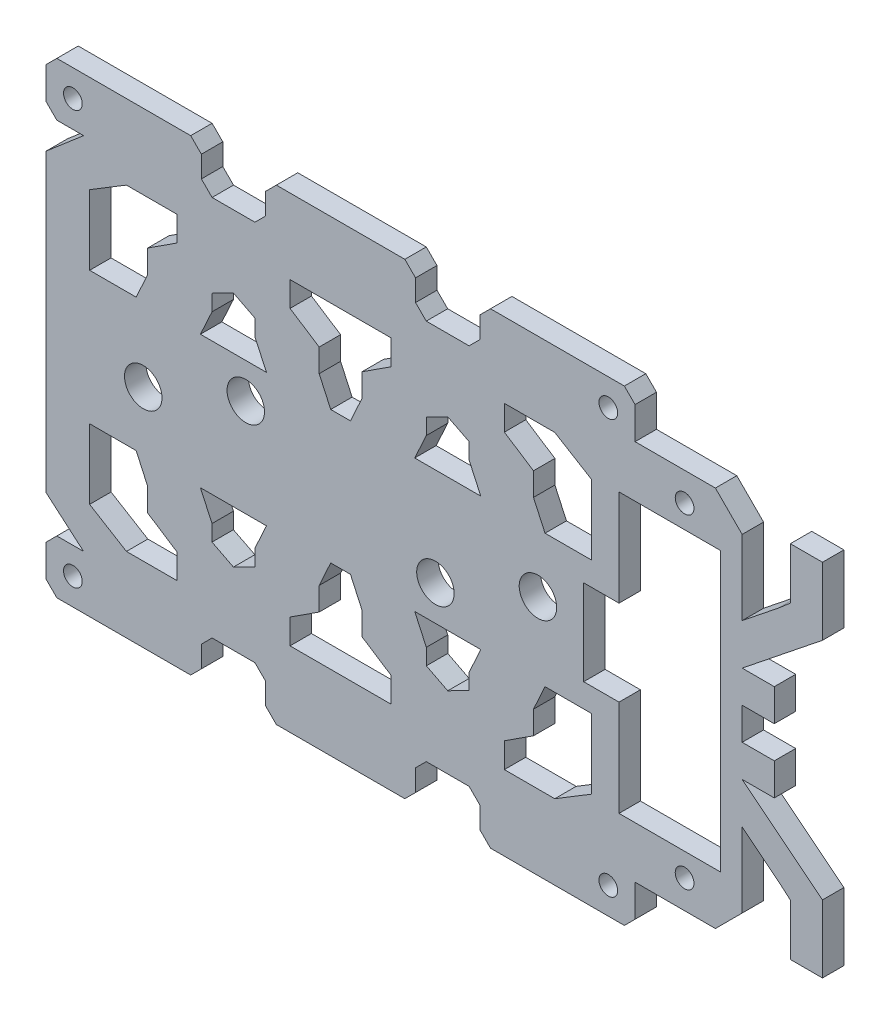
SolidWorks part; units mm, degrees
ref_plane "Front Plane" through (0, 0, 0) normal (0, 0, 1) x (1, 0, 0)
ref_plane "Top Plane" through (0, 0, 0) normal (0, 1, 0) x (1, 0, 0)
ref_plane "Right Plane" through (0, 0, 0) normal (1, 0, 0) x (0, 0, -1)
sketch "Sketch17" [suppressed] plane through (0, 0, 4) normal (0, 0, 1) x (1, 0, 0)
  line L0 (-55, 12.125) -> (-45, 18.2974) construction
  line L1 (-55, 2.5) -> (-55, 39.75) construction
  line L2 (-45, 18.2974) -> (-45, 21.125) construction
  line L3 (-55, 21.125) -> (55, 21.125) construction
  line L4 (-55, 21.125) -> (-55, 12.125) construction
  line L5 (-55, 21.125) -> (55, 21.125) construction
  line L6 (-40, 0) -> (-47.5612, -9.9538) construction
  line L7 (-45, 21.125) -> (-35.9886, 21.125) construction
  line L8 (-40, 0) -> (-45.6995, 11.125) construction
  line L9 (-55, 30.125) -> (-55, 12.125)
  line L10 (-55, 12.125) -> (-45, 18.2974)
  line L11 (-45, 18.2974) -> (-45, 23.9526)
  line L12 (-55, 30.125) -> (-45, 23.9526)
  line L13 (0, 21.125) -> (0, -26.5) construction
  line L14 (55, 12.125) -> (45, 18.2974)
  line L15 (45, 18.2974) -> (45, 23.9526)
  line L16 (55, 30.125) -> (45, 23.9526)
  line L17 (55, 30.125) -> (55, 12.125)
  circle A1 centre (-40, 0) radius 12.5 construction
  point P26 (45, 21.125)
  dimension "D1" = 9
  dimension "D2" = 10
sketch "Sketch46" [suppressed] plane through (0, 0, 4) normal (0, 0, 1) x (1, 0, 0)
  line L0 (34.7834, 34.9205) -> (35.1925, 30.791) construction
  line L1 (35.1925, 30.791) -> (40, 30.791) construction
  line L2 (10, 54.75) -> (10, 43.9931)
  line L3 (15.3638, 40.3741) -> (25.307, 40.3741)
  line L4 (10, 54.75) -> (25.9432, 54.75)
  line L5 (43.3566, 54.75) -> (47, 50.3534)
  line L6 (47, 50.3534) -> (47, 34.0649)
  line L7 (47, 34.0649) -> (40, 30.791)
  line L8 (31.307, 40.3741) -> (34.7834, 34.9205)
  line L9 (34.7834, 34.9205) -> (35.1925, 30.791)
  line L10 (-45, 21.125) -> (-35.1925, 21.125) construction
  line L13 (-4, 60.0044) -> (4, 60.0044) construction
  line L14 (31.307, 51.131) -> (36.6708, 54.75)
  line L15 (31.307, 40.3741) -> (31.307, 54.75) construction
  line L16 (34.7834, 34.9205) -> (31.307, 40.3741) construction
  line L17 (47, 50.3534) -> (42.1411, 53.2998) construction
  line L18 (35.1925, 30.791) -> (40, 30.791)
  line L19 (36.6708, -12.5) -> (43.3566, -12.5)
  line L20 (31.307, 54.75) -> (10, 40.3741) construction
  line L21 (31.307, 40.3741) -> (29.9457, 38.75) construction
  line L22 (43.3566, -12.5) -> (47, -8.1034)
  line L23 (47, -8.1034) -> (47, 8.1851)
  line L24 (47, 8.1851) -> (40, 11.459)
  line L25 (35.1925, 11.459) -> (40, 11.459)
  line L26 (34.7834, 7.3295) -> (35.1925, 11.459)
  line L27 (31.307, 1.8759) -> (34.7834, 7.3295)
  line L28 (31.307, 1.8759) -> (31.307, -8.881)
  line L29 (31.307, -8.881) -> (36.6708, -12.5)
  line L30 (15.3638, 1.8759) -> (25.307, 1.8759)
  line L31 (25.307, -4.8328) -> (25.307, 1.8759)
  line L32 (25.307, -4.8328) -> (15.3638, 1.8759)
  line L33 (25.9432, -12.5) -> (10, -1.7431)
  line L34 (10, -12.5) -> (10, -1.7431)
  line L35 (10, -12.5) -> (25.9432, -12.5)
  line L36 (-10, 54.75) -> (-10, 43.9931)
  line L37 (36.6708, 54.75) -> (43.3566, 54.75)
  line L38 (-10, 54.75) -> (-25.9432, 54.75)
  line L39 (-25.9432, 54.75) -> (-10, 43.9931)
  line L40 (-25.307, 47.0828) -> (-15.3638, 40.3741)
  line L41 (-25.307, 47.0828) -> (-25.307, 40.3741)
  line L42 (-15.3638, 40.3741) -> (-25.307, 40.3741)
  line L43 (-35.1925, 30.791) -> (-40, 30.791)
  line L44 (-34.7834, 34.9205) -> (-35.1925, 30.791)
  line L45 (-31.307, 40.3741) -> (-34.7834, 34.9205)
  line L46 (-31.307, 40.3741) -> (-31.307, 51.131)
  line L47 (-31.307, 51.131) -> (-36.6708, 54.75)
  line L48 (-36.6708, 54.75) -> (-43.3566, 54.75)
  line L49 (-43.3566, 54.75) -> (-47, 50.3534)
  line L50 (-47, 50.3534) -> (-47, 34.0649)
  line L51 (-47, 34.0649) -> (-40, 30.791)
  line L52 (-31.307, 1.8759) -> (-34.7834, 7.3295)
  line L53 (-34.7834, 7.3295) -> (-35.1925, 11.459)
  line L54 (-35.1925, 11.459) -> (-40, 11.459)
  line L55 (-47, 8.1851) -> (-40, 11.459)
  line L56 (-47, -8.1034) -> (-47, 8.1851)
  line L57 (-31.307, -8.881) -> (-36.6708, -12.5)
  line L58 (-43.3566, -12.5) -> (-47, -8.1034)
  line L59 (-36.6708, -12.5) -> (-43.3566, -12.5)
  line L60 (-31.307, 1.8759) -> (-31.307, -8.881)
  line L61 (-15.3638, 1.8759) -> (-25.307, 1.8759)
  line L62 (-25.307, -4.8328) -> (-25.307, 1.8759)
  line L63 (-25.307, -4.8328) -> (-15.3638, 1.8759)
  line L64 (-25.9432, -12.5) -> (-10, -1.7431)
  line L65 (-10, -12.5) -> (-10, -1.7431)
  line L66 (-10, -12.5) -> (-25.9432, -12.5)
  line L67 (-40, 21.125) -> (-35.1925, 21.125) construction
  line L68 (-40, 16.125) -> (-35.1925, 16.125)
  line L69 (-40, 26.125) -> (-35.1925, 26.125)
  line L70 (-40, 21.125) -> (-40, 26.125)
  line L71 (-40, 21.125) -> (-40, 16.125)
  line L72 (-35.1925, 26.125) -> (-35.1925, 21.125)
  line L73 (-35.1925, 21.125) -> (-35.1925, 16.125)
  line L75 (35.1925, 21.125) -> (35.1925, 16.125)
  line L76 (35.1925, 26.125) -> (35.1925, 21.125)
  line L77 (40, 21.125) -> (40, 16.125)
  line L78 (40, 21.125) -> (40, 26.125)
  line L81 (35.1925, 16.125) -> (40, 16.125)
  line L82 (35.1925, 26.125) -> (40, 26.125)
  line L83 (25.9432, 54.75) -> (10, 43.9931)
  line L85 (-4, 60.0044) -> (4, 60.0044)
  line L87 (31.307, 40.3741) -> (31.307, 51.131)
  line L88 (25.307, 40.3741) -> (25.307, 47.0828) construction
  line L89 (25.307, 47.0828) -> (25.307, 40.3741)
  line L90 (25.307, 47.0828) -> (15.3638, 40.3741)
  line L91 (-4, -17.7544) -> (4, -17.7544) construction
  line L92 (4, 60.0044) -> (4, 40.3741)
  line L94 (-4, 60.0044) -> (-4, 40.3741)
  line L95 (-4, -17.7544) -> (4, -17.7544)
  line L96 (-4, 40.3741) -> (4, 40.3741)
  line L107 (-4, 1.8759) -> (4, 1.8759)
  line L108 (-4, 1.8759) -> (-4, -17.7544)
  line L109 (0, 1.8759) -> (0, -15) construction
  line L110 (4, 1.8759) -> (4, -17.7544)
  line L114 (0, 60.0044) -> (0, 40.3741) construction
  line L115 (35.1925, 21.125) -> (45, 21.125) construction
  line L202 (53.2, 66.95) -> (-53.2, 66.95)
  line L204 (-53.2, 66.95) -> (-53.2, -24.7)
  line L221 (-53.2, -24.7) -> (53.2, -24.7)
  line L277 (53.2, -24.7) -> (53.2, 66.95)
sketch "Sketch49" [suppressed] plane through (0, 0, 0) normal (0, 0, 1) x (1, 0, 0)
  line L0 (-45, 21.125) -> (-23.78, 21.125) construction
  line L1 (-45, 18.2974) -> (-45, 23.9526) construction
  line L2 (45, 23.9526) -> (45, 18.2974) construction
  line L3 (-27.28, 14.94) -> (-27.28, 21.125) construction
  line L4 (-27.28, 21.125) -> (-27.28, 33.94) construction
  line L5 (-27.28, 14.94) -> (-27.28, 11.94) construction
  line L7 (-30.78, 11.94) -> (-23.78, 11.94)
  line L8 (-23.78, 11.94) -> (-23.78, 33.94)
  line L9 (-30.78, 10.44) -> (-23.78, 10.44)
  line L10 (-22.28, 21.125) -> (-22.28, 13.726)
  line L11 (-22.28, 13.726) -> (-22.28, 10.44)
  line L12 (-22.28, 10.44) -> (-23.78, 10.44)
  line L13 (-23.78, 33.94) -> (-22.28, 33.94)
  line L14 (-22.28, 33.94) -> (-22.28, 21.125)
  line L15 (-22.28, 21.125) -> (45, 21.125) construction
  line L16 (-32.28, 10.44) -> (-30.78, 10.44)
  line L17 (-32.28, 13.726) -> (-32.28, 10.44)
  line L18 (-32.28, 21.125) -> (-32.28, 13.726)
  line L19 (-32.28, 33.94) -> (-32.28, 21.125)
  line L20 (-30.78, 11.94) -> (-30.78, 33.94)
  line L21 (-30.78, 33.94) -> (-32.28, 33.94)
  line L22 (0, 21.125) -> (0, 68.75) construction
  line L23 (27.28, 27.31) -> (27.28, 8.31) construction
  line L24 (27.28, 27.31) -> (27.28, 30.31) construction
  line L25 (30.78, 30.31) -> (23.78, 30.31)
  line L26 (23.78, 30.31) -> (23.78, 8.31)
  line L27 (23.78, 8.31) -> (22.28, 8.31)
  line L28 (22.28, 8.31) -> (22.28, 29.3349)
  line L29 (27.28, 30.31) -> (27.28, 31.81) construction
  line L30 (32.28, 31.81) -> (22.28, 31.81)
  line L31 (22.28, 31.81) -> (22.28, 29.3349)
  line L32 (30.78, 8.31) -> (32.28, 8.31)
  line L33 (30.78, 30.31) -> (30.78, 8.31)
  line L34 (32.28, 8.31) -> (32.28, 29.3349)
  line L35 (32.28, 31.81) -> (32.28, 29.3349)
  point P23 (-27.28, 10.44)
  dimension "D6" = 19
  dimension "D7" = 3
  dimension "D8" = 3.5
  dimension "D9" = 1.5
  dimension "D10" = 1.5
sketch "Sketch51" plane through (0, 0, 0) normal (0, 0, 1) x (1, 0, 0)
  line L0 (-55, 60.75) -> (-55, 50.75)
  line L1 (-55, -16.5) -> (-55, -26.5) construction
  line L2 (-55, -26.5) -> (55, -26.5) construction
  line L3 (75, 17.125) -> (75, 33.8069) construction
  line L4 (-55, -26.5) -> (55, -26.5)
  line L5 (55, 60.75) -> (55, 54.625)
  line L6 (0, 4.7155) -> (0, 60.75) construction
  line L7 (-55, 60.75) -> (55, 60.75)
  line L8 (-55, 17.125) -> (75, 17.125) construction
  line L9 (-4, -2.1241) -> (-4, -4.3102) construction
  line L10 (1.8445, 4.7155) -> (4, 0)
  line L11 (4, -2.1241) -> (4, 0)
  line L12 (4, -2.1241) -> (4, -4.3102)
  line L13 (-48, 50.75) -> (-55, 50.75)
  line L14 (4, -4.3102) -> (9.4424, -7.8357)
  line L15 (9.4424, -7.8357) -> (9.4424, -12.5)
  line L16 (-55, 44.75) -> (-48, 50.75)
  line L17 (16.0138, 0) -> (16.0138, -3)
  line L18 (13.8445, 4.7155) -> (16.0138, 0)
  line L19 (-55, -16.5) -> (-55, -26.5)
  line L20 (-1.8445, 4.7155) -> (1.8445, 4.7155)
  line L21 (-9.4424, -7.8357) -> (-9.4424, -12.5) construction
  line L22 (16.0138, -3) -> (20.0138, -5.0367)
  line L23 (-55, -26.5) -> (-55, 60.75)
  line L24 (-4, -2.1241) -> (-4, -4.3102)
  line L25 (26.183, 4.7155) -> (24.0275, 0)
  line L26 (-38.183, 4.7155) -> (-41.872, 4.7155)
  line L27 (-26.183, 4.7155) -> (-24.0275, 0)
  line L28 (-55, -10.5) -> (-48, -16.5)
  line L29 (-38.183, 4.7155) -> (-36.0275, 0)
  line L30 (-36.0275, -2.1241) -> (-36.0275, 0)
  line L31 (-36.0275, -2.1241) -> (-36.0275, -4.3102)
  line L32 (-36.0275, -4.3102) -> (-30.5852, -7.8357)
  line L33 (-30.5852, -7.8357) -> (-30.5852, -12.5)
  line L34 (0, 4.7155) -> (0, -26.5) construction
  line L35 (26.183, 4.7155) -> (13.8445, 4.7155)
  line L36 (24.0138, 0) -> (24.0138, -3)
  line L37 (24.0138, -3) -> (20.0138, -5.0367)
  line L38 (30.5852, -12.5) -> (40, -12.5)
  line L39 (-30.5852, -12.5) -> (-40, -12.5)
  line L40 (-48, -16.5) -> (-55, -16.5)
  line L41 (-41.872, 4.7155) -> (-46.872, 4.7155)
  line L42 (-4, -4.3102) -> (-9.4424, -7.8357) construction
  line L43 (30.5852, -7.8357) -> (30.5852, -12.5)
  line L44 (36.0275, -4.3102) -> (30.5852, -7.8357)
  line L45 (36.0275, -2.1241) -> (36.0275, -4.3102)
  line L46 (36.0275, -2.1241) -> (36.0275, 0)
  line L47 (38.183, 4.7155) -> (36.0275, 0)
  line L48 (75, 17.125) -> (93.6787, 17.125) construction
  line L49 (75, 20.125) -> (75, 14.125)
  line L50 (46.872, 4.7155) -> (46.872, -8.3277)
  line L51 (40, -12.5) -> (46.872, -8.3277)
  line L52 (-4, -4.3102) -> (-9.4424, -7.8357)
  line L53 (-9.4424, -7.8357) -> (-9.4424, -12.5)
  line L54 (-9.4424, -12.5) -> (9.4424, -12.5)
  line L55 (-26.183, 29.5345) -> (-13.8445, 29.5345) construction
  line L56 (-4, 38.5602) -> (-9.4424, 42.0857) construction
  line L57 (-9.4424, 42.0857) -> (-9.4424, 46.75) construction
  line L58 (-4, 36.3741) -> (-4, 38.5602) construction
  line L59 (-26.183, 29.5345) -> (-13.8445, 29.5345)
  line L60 (-16.0138, 37.25) -> (-20.0138, 39.2867)
  line L61 (-24.0138, 37.25) -> (-20.0138, 39.2867)
  line L62 (-16.0138, 34.25) -> (-16.0138, 37.25)
  line L63 (-26.183, 29.5345) -> (-24.0138, 34.25)
  line L64 (-24.0138, 34.25) -> (-24.0138, 37.25)
  line L65 (-13.8445, 29.5345) -> (-16.0138, 34.25)
  line L66 (-40, 46.75) -> (-46.872, 42.5777)
  line L67 (-1.8445, 29.5345) -> (-4, 34.25)
  line L68 (-4, 36.3741) -> (-4, 34.25)
  line L69 (-46.872, 29.5345) -> (-46.872, 42.5777)
  line L70 (-9.4424, 46.75) -> (9.4424, 46.75)
  line L71 (-9.4424, 42.0857) -> (-9.4424, 46.75)
  line L72 (-4, 38.5602) -> (-9.4424, 42.0857)
  line L73 (40, 46.75) -> (46.872, 42.5777)
  line L74 (46.872, 29.5345) -> (46.872, 42.5777)
  line L75 (55, 54.625) -> (55, 52.75)
  line L76 (-46.872, 4.7155) -> (-46.872, -8.3277)
  line L77 (-4, -2.1241) -> (-4, 0)
  line L79 (38.183, 29.5345) -> (36.0275, 34.25)
  line L80 (36.0275, 36.3741) -> (36.0275, 34.25)
  line L81 (36.0275, 36.3741) -> (36.0275, 38.5602)
  line L82 (36.0275, 38.5602) -> (30.5852, 42.0857)
  line L83 (30.5852, 42.0857) -> (30.5852, 46.75)
  line L84 (-48, -16.5) -> (-55, -16.5)
  line L85 (55, -26.5) -> (55, -18.5)
  line L88 (75, 46.75) -> (75, 33.8069)
  line L89 (-48, 50.75) -> (-55, 50.75)
  line L90 (-1.8445, 4.7155) -> (-4, 0)
  line L91 (-26, -18.5) -> (-26, -26.5)
  line L92 (-26, -18.5) -> (-14, -18.5)
  line L93 (-14, -18.5) -> (-14, -26.5)
  line L94 (14, -18.5) -> (14, -26.5)
  line L95 (14, -18.5) -> (26, -18.5)
  line L96 (26, -18.5) -> (26, -26.5)
  line L97 (26, 52.75) -> (26, 60.75)
  line L98 (14, 52.75) -> (26, 52.75)
  line L99 (14, 52.75) -> (14, 60.75)
  line L100 (-14, 52.75) -> (-14, 60.75)
  line L101 (-26, 52.75) -> (-14, 52.75)
  line L102 (-26, 52.75) -> (-26, 60.75)
  line L103 (-41.872, 29.5345) -> (-46.872, 29.5345)
  line L104 (-30.5852, 46.75) -> (-40, 46.75)
  line L105 (30.5852, 46.75) -> (40, 46.75)
  line L106 (-40, -12.5) -> (-46.872, -8.3277)
  line L107 (24.0138, 37.25) -> (20.0138, 39.2867)
  line L108 (24.0138, 34.25) -> (24.0138, 37.25)
  line L109 (26.183, 29.5345) -> (13.8445, 29.5345)
  line L110 (-30.5852, 42.0857) -> (-30.5852, 46.75)
  line L111 (-36.0275, 38.5602) -> (-30.5852, 42.0857)
  line L112 (-36.0275, 36.3741) -> (-36.0275, 38.5602)
  line L113 (-36.0275, 36.3741) -> (-36.0275, 34.25)
  line L114 (-38.183, 29.5345) -> (-36.0275, 34.25)
  line L115 (-13.8445, 4.7155) -> (-16.0138, 0)
  line L116 (-24.0138, 0) -> (-24.0138, -3)
  line L117 (-26.183, 4.7155) -> (-24.0138, 0)
  line L118 (-26.183, 4.7155) -> (-13.8445, 4.7155) construction
  line L119 (-55, -26.5) -> (-55, -16.5)
  line L120 (-16.0138, 0) -> (-16.0138, -3)
  line L121 (-24.0138, -3) -> (-20.0138, -5.0367)
  line L122 (-16.0138, -3) -> (-20.0138, -5.0367)
  line L123 (-26.183, 4.7155) -> (-13.8445, 4.7155)
  line L124 (-26.183, 29.5345) -> (-24.0275, 34.25)
  line L125 (-38.183, 29.5345) -> (-41.872, 29.5345)
  line L126 (26.183, 29.5345) -> (24.0275, 34.25)
  line L127 (-4, 36.3741) -> (-4, 38.5602)
  line L128 (16.0138, 37.25) -> (20.0138, 39.2867)
  line L129 (-1.8445, 29.5345) -> (1.8445, 29.5345)
  line L130 (13.8445, 29.5345) -> (16.0138, 34.25)
  line L131 (16.0138, 34.25) -> (16.0138, 37.25)
  line L132 (9.4424, 42.0857) -> (9.4424, 46.75)
  line L133 (4, 38.5602) -> (9.4424, 42.0857)
  line L134 (4, 36.3741) -> (4, 38.5602)
  line L135 (4, 36.3741) -> (4, 34.25)
  line L136 (1.8445, 29.5345) -> (4, 34.25)
  line L137 (75, -12.5) -> (75, 0.4431)
  line L139 (65, 46.75) -> (65, 17.125) construction
  line L140 (75, -12.5) -> (75, -18.5)
  line L141 (-48, -16.5) -> (-55, -16.5)
  line L142 (75, -18.5) -> (55, -18.5)
  line L143 (75, 46.75) -> (75, 52.75)
  line L144 (75, 14.125) -> (81, 14.125)
  line L145 (81, 14.125) -> (81, 8.125)
  line L146 (81, 8.125) -> (75, 8.125)
  line L147 (75, 8.125) -> (83.3808, 1.4246)
  line L148 (83.3808, 1.4246) -> (90, -3.8675)
  line L149 (90, -3.8675) -> (90, -16.5)
  line L150 (90, -16.5) -> (84, -16.5)
  line L151 (75, 0.4431) -> (79.6341, -3.2618)
  line L152 (79.6341, -3.2618) -> (81.737, -4.9431)
  line L153 (81.737, -4.9431) -> (81.737, -4.9431)
  line L154 (81.737, -4.9431) -> (81.737, -4.9431)
  line L155 (75, 14.125) -> (75, 20.125)
  line L156 (75, 14.125) -> (75, 20.125) construction
  line L157 (84, -10.5) -> (84, -16.5)
  line L158 (81.737, -4.9431) -> (81.737, -4.9431)
  line L159 (75, 52.75) -> (55, 52.75)
  line L160 (84, -10.5) -> (84, -6.8809)
  line L161 (81.737, -4.9431) -> (84, -6.8809)
  line L162 (71.2533, 3.4386) -> (79.6341, -3.2618) construction
  line L163 (81.737, 39.1931) -> (84, 41.1309)
  line L164 (84, 44.75) -> (84, 41.1309)
  line L166 (84, 44.75) -> (84, 50.75)
  line L167 (79.6341, 37.5118) -> (81.737, 39.1931)
  line L168 (75, 33.8069) -> (79.6341, 37.5118)
  line L169 (90, 50.75) -> (84, 50.75)
  line L170 (90, 38.1175) -> (90, 50.75)
  line L171 (83.3808, 32.8254) -> (90, 38.1175)
  line L172 (75, 26.125) -> (83.3808, 32.8254)
  line L173 (81, 26.125) -> (75, 26.125)
  line L174 (81, 20.125) -> (81, 26.125)
  line L175 (75, 20.125) -> (81, 20.125)
  line L177 (46.872, 4.7155) -> (38.183, 4.7155)
  line L178 (46.872, 29.5345) -> (38.183, 29.5345)
  circle A2 centre (-50, -21.5) radius 1.75
  circle A3 centre (-40, -22.5) radius 2.5
  circle A4 centre (0, -22.5) radius 2.5
  circle A5 centre (40, -22.5) radius 2.5
  circle A6 centre (50, -21.5) radius 1.75
  circle A7 centre (50, 55.75) radius 1.75
  circle A8 centre (40, 56.75) radius 2.5
  circle A9 centre (0, 56.75) radius 2.5
  circle A10 centre (-40, 56.75) radius 2.5
  circle A11 centre (-50, 55.75) radius 1.75
  point P22 (0, -12.5)
  point P40 (0, -12.5)
  point P43 (0, -2.1241)
  point P87 (-47, 17.125)
  point P93 (65, 52.75)
  point P95 (65, -18.5)
  point P161 (0, 36.3741)
  point P162 (0, 46.75)
  dimension "D2" = 6
  dimension "D3" = 6
  dimension "D1" = 29.625
  dimension "D4" = 8
  dimension "D5" = 71.25
extrude "Boss-Extrude2" add sketch "Sketch51" along normal blind 4
sketch "Sketch52" [suppressed] plane through (0, 0, 4) normal (0, 0, 1) x (1, 0, 0)
  line L0 (0, 36.3741) -> (0, -2.1241) construction
  line L2 (35.6535, 29.5345) -> (35.6535, 4.7155) construction
  line L5 (0, 31.3741) -> (0, 17.125) construction
  line L6 (0, 17.125) -> (0, 2.8759) construction
  line L7 (-18.5852, 42.0857) -> (-18.5852, -7.8357) construction
  line L8 (24.0275, 38.5602) -> (24.0275, 0) construction
  line L9 (0, 31.3741) -> (-18.5852, 31.3741) construction
  line L10 (-18.5852, 17.125) -> (-18.5852, 31.3741)
  line L11 (-18.5852, 31.3741) -> (55, 31.3741)
  line L13 (-18.5852, 17.125) -> (-18.5852, 2.8759) construction
  line L14 (-18.5852, 2.8759) -> (0, 2.8759) construction
  line L15 (0, 2.8759) -> (55, 2.8759) construction
  line L16 (55, 2.8759) -> (55, 31.3741) construction
  line L17 (-18.5852, 17.125) -> (-18.5852, 2.8759)
  line L18 (-18.5852, 2.8759) -> (0, 2.8759)
  line L19 (0, 2.8759) -> (55, 2.8759)
  line L20 (55, 2.8759) -> (55, 31.3741)
extrude "Cut-Extrude4" [suppressed] cut sketch "Sketch52" against normal blind 2
sketch "Sketch53" plane through (0, 0, 4) normal (0, 0, 1) x (1, 0, 0)
  line L0 (13.8445, 29.5345) -> (26.183, 29.5345)
  line L1 (26.183, 29.5345) -> (24.0138, 34.25)
  line L2 (24.0138, 34.25) -> (24.0138, 37.25)
  line L3 (24.0138, 37.25) -> (20.0138, 39.2867)
  line L4 (20.0138, 39.2867) -> (16.0138, 37.25)
  line L5 (16.0138, 37.25) -> (16.0138, 34.25)
  line L6 (16.0138, 34.25) -> (13.8445, 29.5345)
  line L7 (13.8445, 4.7155) -> (26.183, 4.7155)
  line L8 (26.183, 4.7155) -> (24.0275, 0)
  line L9 (24.0275, 0) -> (24.0138, -3)
  line L10 (24.0138, -3) -> (20.0138, -5.0367)
  line L11 (20.0138, -5.0367) -> (16.0138, -3)
  line L12 (16.0138, -3) -> (16.0138, 0)
  line L13 (16.0138, 0) -> (13.8445, 4.7155)
extrude "Cut-Extrude5" cut sketch "Sketch53" against normal through all
sketch "Sketch54" plane through (0, 0, 4) normal (0, 0, 1) x (1, 0, 0)
  line L0 (38.183, 29.5345) -> (38.183, 4.7155)
  line L1 (38.183, 4.7155) -> (46.872, 4.7155)
  line L2 (46.872, 4.7155) -> (46.872, 29.5345)
  line L3 (46.872, 29.5345) -> (38.183, 29.5345)
extrude "Cut-Extrude6" [suppressed] cut sketch "Sketch54" against normal through all
chamfer "Chamfer1" distance 2 angle 45 22 edges at (26, -18.5, 2) (-14, -18.5, 2) (-14, -26.5, 2) (-55, -26.5, 2) (-26, -26.5, 2) (-26, -18.5, 2) (26, -26.5, 2) (14, -18.5, 2) (14, -26.5, 2) (14, 52.75, 2) (14, 60.75, 2) (-26, 52.75, 2) (26, 52.75, 2) (26, 60.75, 2) (-55, -16.5, 2) (-14, 52.75, 2) (-14, 60.75, 2) (-26, 60.75, 2) (-55, 50.75, 2) (-55, 60.75, 2) (55, 60.75, 2) (55, -26.5, 2)
sketch "Sketch55" plane through (0, 0, 4) normal (0, 0, 1) x (1, 0, 0)
  line L0 (55, 60.75) -> (55, 18.6) construction
  line L1 (55, 18.6) -> (36.86, 18.6) construction
  line L2 (55, 60.75) -> (55, 11.28) construction
  line L3 (55, 11.28) -> (17.71, 11.28) construction
  line L4 (-55, 60.75) -> (-55, 22.97) construction
  line L5 (-55, -26.5) -> (-55, 60.75) construction
  line L6 (-55, 22.97) -> (-17.71, 22.97) construction
  line L7 (-55, 60.75) -> (-55, 15.65) construction
  line L8 (-55, 15.65) -> (-36.86, 15.65) construction
  circle A0 centre (36.86, 18.6) radius 3.5
  circle A1 centre (17.71, 11.28) radius 3.5
  circle A2 centre (-17.71, 22.97) radius 3.5
  circle A3 centre (-36.86, 15.65) radius 3.5
  dimension "D3" = 7
  dimension "D6" = 7
  dimension "D9" = 7
  dimension "D12" = 7
  dimension "D1" = 42.15
  dimension "D2" = 18.14
  dimension "D4" = 49.47
  dimension "D5" = 37.29
  dimension "D7" = 37.78
  dimension "D8" = 37.29
  dimension "D10" = 45.1
  dimension "D11" = 18.14
extrude "Cut-Extrude7" cut sketch "Sketch55" against normal blind 10
sketch "Sketch56" plane through (0, 0, 4) normal (0, 0, 1) x (1, 0, 0)
  line L0 (55, 60.75) -> (55, -26.5) construction
  line L1 (55, 17.125) -> (55, 54.625) construction
  dimension "D1" = 37.5
sketch "Sketch57" plane through (0, 0, 4) normal (0, 0, 1) x (1, 0, 0)
  line L1 (54.4038, 9.125) -> (45.4038, 9.125)
  line L2 (54.4038, 9.125) -> (54.4038, 25.125)
  line L3 (54.4038, 25.125) -> (45.4038, 25.125)
  line L4 (45.4038, 9.125) -> (45.4038, 25.125)
  line L5 (54.4038, 9.125) -> (45.4038, 25.125) construction
  line L6 (54.4038, 25.125) -> (45.4038, 9.125) construction
  point P0 (50.4038, 17.125)
  dimension "D1" = 9
extrude "Cut-Extrude8" cut sketch "Sketch57" against normal through all
chamfer "Chamfer2" distance 5 angle 45 2 edges at (75, 52.75, 2) (75, -18.5, 2)
sketch "Sketch58" plane through (0, 0, 0) normal (0, 0, -1) x (-1, 0, 0)
  line L10 (-64, 43.125) -> (-53, 43.125)
  line L11 (-53, 43.125) -> (-52, 43.125)
  line L12 (-52, 43.125) -> (-52, -8.875)
  line L13 (-64, 43.125) -> (-71, 43.125)
  line L14 (-71, 43.125) -> (-71, -8.875)
  line L15 (-64, -8.875) -> (-71, -8.875)
  line L16 (-53, -8.875) -> (-52, -8.875)
  line L17 (-64, -8.875) -> (-53, -8.875)
extrude "Cut-Extrude9" cut sketch "Sketch58" against normal through all
sketch "Sketch59" plane through (0, 0, 0) normal (0, 0, -1) x (-1, 0, 0)
  line L0 (-75, -13.19) -> (-64.25, -13.19)
  line L1 (-75, 0.4431) -> (-75, -13.5) construction
  line L2 (-64.25, -13.19) -> (-64.25, -18.5)
  line L3 (-70, -18.5) -> (-55, -18.5) construction
  line L4 (-75, 47.44) -> (-64.25, 47.44)
  line L5 (-75, 47.75) -> (-75, 33.8069) construction
  line L7 (-70, 52.75) -> (-55, 52.75) construction
  circle A0 centre (-64.25, -13.19) radius 1.75
  circle A1 centre (-64.25, 47.44) radius 1.75
  dimension "D3" = 3.5
  dimension "D6" = 3.5
  dimension "D1" = 5.31
  dimension "D2" = 10.75
  dimension "D4" = 10.75
  dimension "D5" = 5.31
extrude "Cut-Extrude10" cut sketch "Sketch59" against normal blind 10
